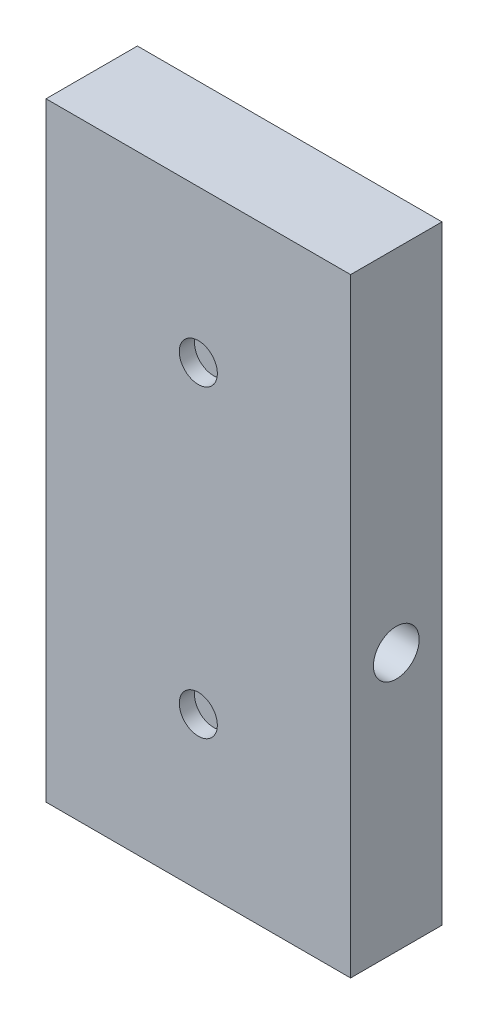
SolidWorks part; units mm, degrees
ref_plane "Face" through (0, 0, 0) normal (0, 0, 1) x (1, 0, 0)
ref_plane "Dessus" through (0, 0, 0) normal (0, 1, 0) x (1, 0, 0)
ref_plane "Droite" through (0, 0, 0) normal (1, 0, 0) x (0, 0, -1)
sketch "Esquisse1" plane through (0, 0, 0) normal (0, 0, 1) x (1, 0, 0)
  line L1 (-36.6811, 34.5313) -> (-16.6811, 34.5313)
  line L2 (-36.6811, 34.5313) -> (-36.6811, -5.4687)
  line L3 (-36.6811, -5.4687) -> (-16.6811, -5.4687)
  line L4 (-16.6811, 34.5313) -> (-16.6811, -5.4687)
  dimension "D1" = 20
  dimension "D2" = 40
extrude "Extrusion1" add sketch "Esquisse1" along normal blind 6
sketch "Esquisse2" plane through (-16.6811, 0, 0) normal (1, 0, 0) x (0, 0, -1)
  line L0 (-3, -5.4687) -> (-3, 34.5313) construction
  line L1 (-6, -5.4687) -> (0, -5.4687) construction
  line L2 (-6, 34.5313) -> (0, 34.5313) construction
  circle A0 centre (-3, 11.5313) radius 1.5
  dimension "D1" = 3
  dimension "D2" = 17
extrude "Enlèv. mat.-Extru.1" cut sketch "Esquisse2" against normal blind 10
sketch "Esquisse3" plane through (0, 0, 0) normal (0, 0, -1) x (-1, 0, 0)
  line L0 (26.6811, -5.4687) -> (26.6811, 34.5313) construction
  line L1 (36.6811, -5.4687) -> (16.6811, -5.4687) construction
  line L2 (16.6811, 34.5313) -> (36.6811, 34.5313) construction
  line L3 (16.6811, 14.5313) -> (36.6811, 14.5313) construction
  line L4 (16.6811, -5.4687) -> (16.6811, 34.5313) construction
  line L5 (36.6811, 34.5313) -> (36.6811, -5.4687) construction
  circle A0 centre (26.6811, -2.4687) radius 1.25
  circle A1 centre (26.6811, 31.5313) radius 1.25
  dimension "D1" = 2.5
  dimension "D2" = 3
extrude "Enlèv. mat.-Extru.2" cut sketch "Esquisse3" against normal blind 1
sketch "Esquisse4" plane through (0, 0, 6) normal (0, 0, 1) x (1, 0, 0)
  line L0 (-26.6811, -5.4687) -> (-26.6811, 34.5313) construction
  line L1 (-36.6811, -5.4687) -> (-16.6811, -5.4687) construction
  line L2 (-16.6811, 34.5313) -> (-36.6811, 34.5313) construction
  line L3 (-36.6811, 14.5313) -> (-16.6811, 14.5313) construction
  line L4 (-36.6811, 34.5313) -> (-36.6811, -5.4687) construction
  line L5 (-16.6811, -5.4687) -> (-16.6811, 34.5313) construction
  circle A0 centre (-26.6811, 4.5313) radius 1.25
  circle A1 centre (-26.6811, 24.5313) radius 1.25
  dimension "D1" = 2.5
  dimension "D2" = 10
extrude "Enlèv. mat.-Extru.3" cut sketch "Esquisse4" against normal blind 1
sketch "Esquisse5" plane through (0, 0, 0) normal (0, 0, -1) x (-1, 0, 0)
  line L0 (26.6811, 11.5313) -> (16.6811, 11.5313) construction
  line L1 (16.6811, -5.4687) -> (16.6811, 34.5313) construction
  circle A0 centre (21.6811, 11.5313) radius 1
  dimension "D1" = 5
extrude "Enlèv. mat.-Extru.4" cut sketch "Esquisse5" against normal blind 2
